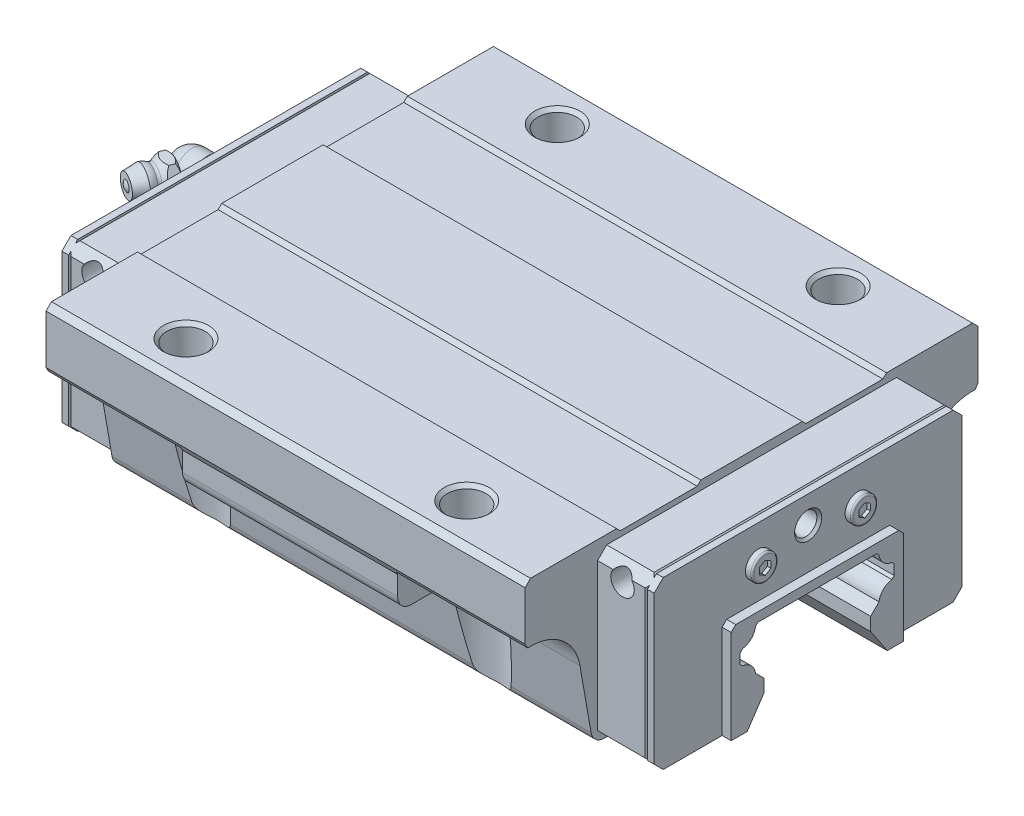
SolidWorks part; units mm, degrees
ref_plane "Front Plane" through (0, 0, 0) normal (0, 0, 1) x (1, 0, 0)
ref_plane "Top Plane" through (0, 0, 0) normal (0, 1, 0) x (1, 0, 0)
ref_plane "Right Plane" through (0, 0, 0) normal (1, 0, 0) x (0, 0, -1)
imported_body "HSR35LC1SS-280L_G20_0_B-M6F_72-6_0_0_0_1.stp-1/_HSR35LCSSB-M6F1 Slider-1.stp-1-solid1"
imported_body "HSR35LC1SS-280L_G20_0_B-M6F_72-6_0_0_0_1.stp-1/_hsr_ftht_B-M6F_grease_nipple_joint.stp-1-solid1"
move or copy body "Body-Move/Copy1" bodies to move or copy 104 103 copy no translate (-120, 0, 0)
